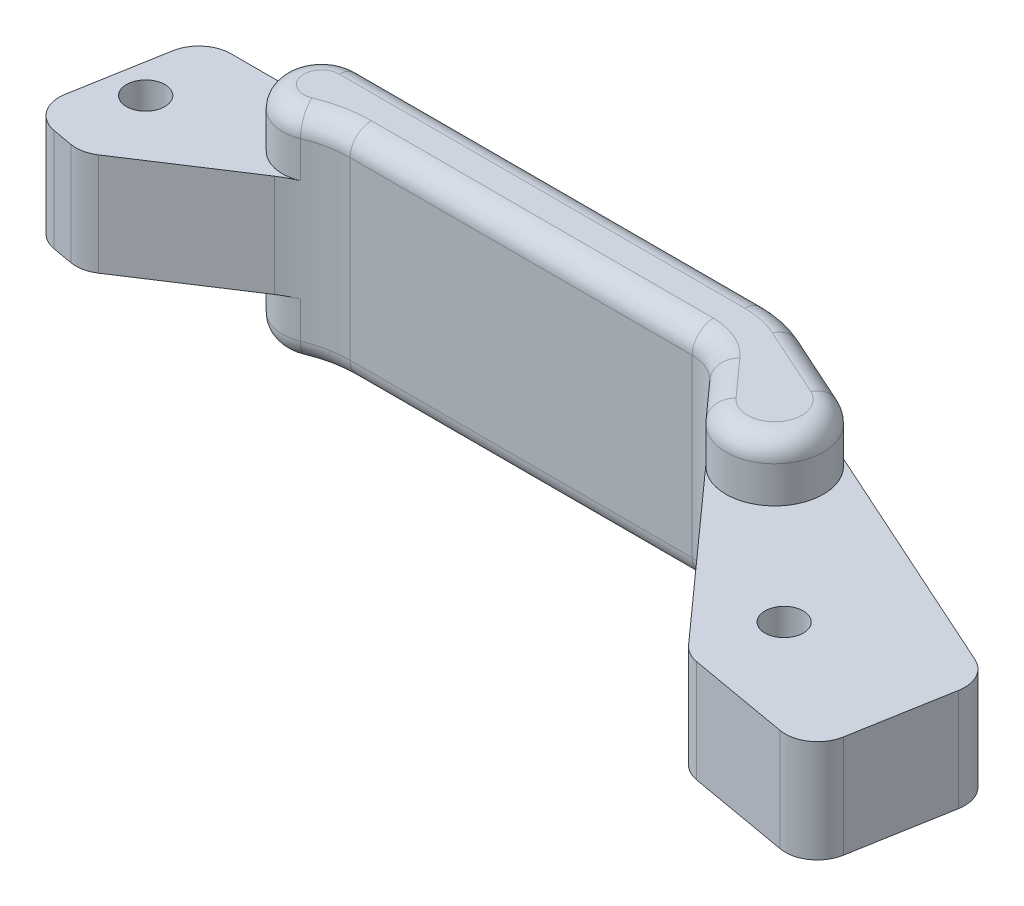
SolidWorks part; units mm, degrees
ref_plane "Front Plane" through (0, 0, 0) normal (0, 0, 1) x (1, 0, 0)
ref_plane "Top Plane" through (0, 0, 0) normal (0, 1, 0) x (1, 0, 0)
ref_plane "Right Plane" through (0, 0, 0) normal (1, 0, 0) x (0, 0, -1)
sketch "Sketch1" plane through (0, 0, 0) normal (0, 0, 1) x (1, 0, 0)
  line L7 (-23.4188, 0) -> (23.4188, 0) construction
  line L8 (-25.4381, -4.4103) -> (-25.4381, 4.6196)
  line L9 (-25.4381, 4.6196) -> (-21.5627, 4.6196)
  line L10 (-24.5618, 0) -> (-25.4381, 0) construction
  line L11 (-24.5618, 0) -> (-25.4381, 0.1046) construction
  line L16 (23.4188, 1.143) -> (23.4188, 4.6736) construction
  line L30 (23.0167, 4.6736) -> (31.7119, 4.6736)
  line L31 (23.4188, 0) -> (24.1561, 0.8734) construction
  line L32 (24.1561, 0.8734) -> (27.3643, 4.6736) construction
  line L33 (31.7119, 4.6736) -> (31.7119, -4.6408)
  line L34 (-25.4381, -4.4103) -> (7.507, -10.2195)
  line L35 (-25.4381, -4.4103) -> (8.8519, -4.4103) construction
  line L36 (10.1753, -10.1199) -> (31.7119, -4.6408)
  line L37 (9.7981, -5.7173) -> (23.0167, 4.6736)
  line L39 (7.7873, -6.2218) -> (-12.262, -2.6865)
  line L40 (8.8465, -10.3115) -> (8.8465, -6.184) construction
  line L41 (-15.5039, -1.0642) -> (-21.5627, 4.6196)
  line L42 (23.4188, 0) -> (22.3147, 0.2958) construction
  line L43 (22.3147, 0.2958) -> (18.4825, 1.3227) construction
  line L44 (18.4825, 1.3227) -> (23.0167, 4.6736) construction
  line L45 (-23.4188, 0) -> (-22.6598, 0.8546) construction
  line L46 (-22.6598, 0.8546) -> (-20.337, 3.4697) construction
  line L47 (-20.337, 3.4697) -> (-21.5627, 4.6196) construction
  circle A6 centre (-23.4188, 0) radius 1.143
  circle A7 centre (23.4188, 0) radius 1.143
  arc A8 (7.507, -10.2195) -> (10.1753, -10.1199) centre (8.6097, -3.9659) ccw
  arc A9 (7.7873, -6.2218) -> (9.7981, -5.7173) centre (8.2283, -3.7204) ccw
  arc A10 (23.0167, 4.6736) -> (18.4825, 1.3227) centre (12.5096, 14.1479) cw construction
  arc A11 (-12.262, -2.6865) -> (-15.5039, -1.0642) centre (-11.1594, 3.567) cw
  point P3 (0, 0)
  point P24 (8.8519, -10.4566)
  dimension "D4" = 3.8754
  dimension "D2" = 2.286
  dimension "D13" = 6.35
  dimension "D14" = 2.54
  dimension "D17" = 14.1478
  dimension "D21" = 6.35
  dimension "D1" = 46.8376
  dimension "D3" = 9.0299
  dimension "D5" = 0.8763
  dimension "D6" = 0.8825
  dimension "D7" = 3.5306
  dimension "D8" = 4.9733
  dimension "D9" = 8.6953
  dimension "D10" = 9.3144
  dimension "D11" = 10
  dimension "D12" = 34.29
  dimension "D15" = 4.1275
  dimension "D16" = 3.9675
  dimension "D18" = 5.638
  dimension "D19" = 3.4978
  dimension "D20" = 1.6806
extrude "Boss-Extrude1" add sketch "Sketch1" along normal mid plane 6.096
sketch "Sketch2" plane through (0, 0, 0) normal (0, 0, 1) x (1, 0, 0)
  line L0 (-25.4381, -4.4103) -> (7.507, -10.2195) construction
  line L1 (23.0167, 4.6736) -> (9.7981, -5.7173) construction
  line L2 (10.1753, -10.1199) -> (31.7119, -4.6408) construction
  line L3 (-12.262, -2.6865) -> (7.7873, -6.2218)
  line L4 (-16.2564, -6.0293) -> (7.507, -10.2195)
  line L5 (12.1012, -3.9068) -> (9.7981, -5.7173)
  line L7 (10.1753, -10.1199) -> (14.6062, -8.9926)
  line L8 (-23.4188, 0) -> (-22.3829, -0.4831) construction
  line L9 (-22.3829, -0.4831) -> (-19.2128, -1.9613) construction
  line L10 (-23.4188, 0) -> (-22.2758, 0) construction
  line L11 (23.4188, 0) -> (22.5096, -0.6927) construction
  line L12 (22.5096, -0.6927) -> (17.8351, -4.2543) construction
  line L13 (17.8351, -4.2543) -> (23.4188, -4.2543) construction
  line L14 (23.4188, -4.2543) -> (23.4188, 0) construction
  arc A0 (-14.5923, -1.7751) -> (-16.2564, -6.0293) centre (-15.8518, -3.735) ccw
  arc A1 (12.1012, -3.9068) -> (14.6062, -8.9926) centre (13.8918, -6.1847) cw
  arc A2 (7.7873, -6.2218) -> (9.7981, -5.7173) centre (8.2283, -3.7204) ccw
  arc A3 (7.507, -10.2195) -> (10.1753, -10.1199) centre (8.6097, -3.9659) ccw
  arc A4 (-14.5923, -1.7751) -> (-12.262, -2.6865) centre (-11.1594, 3.567) ccw
  arc A5 (-15.5039, -1.0642) -> (-12.262, -2.6865) centre (-11.1594, 3.567) ccw construction
  circle A6 centre (-23.4188, 0) radius 1.143 construction
  circle A7 centre (23.4188, 0) radius 1.143 construction
  dimension "D1" = 3.4978
  dimension "D2" = 25
  dimension "D3" = 24.13
  dimension "D4" = 5.8768
  dimension "D5" = 5.5837
  dimension "D6" = 4.572
extrude "Boss-Extrude2" add sketch "Sketch2" along normal mid plane 12.9794
fillet "Fillet1" radius 1.905 6 edges at (-25.4381, -4.4103, 0) (23.0167, 4.6736, 0) (31.7119, -4.6408, 0) (31.7119, 4.6736, 0) (-21.5627, 4.6196, 0) (-25.4381, 4.6196, 0)
fillet "Fillet2" radius 1.27 18 edges at (8.8465, -6.184, -6.4897) (10.9496, -4.812, -6.4897) (16.4911, -4.9045, -6.4897) (12.3908, -9.5563, -6.4897) (8.8465, -10.3115, -6.4897) (-4.3747, -8.1244, -6.4897) (-18.0215, -2.8863, -6.4897) (-13.4725, -2.3467, -6.4897) (8.8465, -6.184, 6.4897) (10.9496, -4.812, 6.4897) (16.4911, -4.9045, 6.4897) (12.3908, -9.5563, 6.4897) (8.8465, -10.3115, 6.4897) (-4.3747, -8.1244, 6.4897) (-18.0215, -2.8863, 6.4897) (-13.4725, -2.3467, 6.4897) (-2.2374, -4.4542, -6.4897) (-2.2374, -4.4542, 6.4897)
move or copy body "Body-Move/Copy1" bodies to move or copy 106 copy no rotation origin (-0.1958, -2.5296, -0.2916) rotation axis (0.9924, -0.0868, 0.0868) rotation angle 90.435
